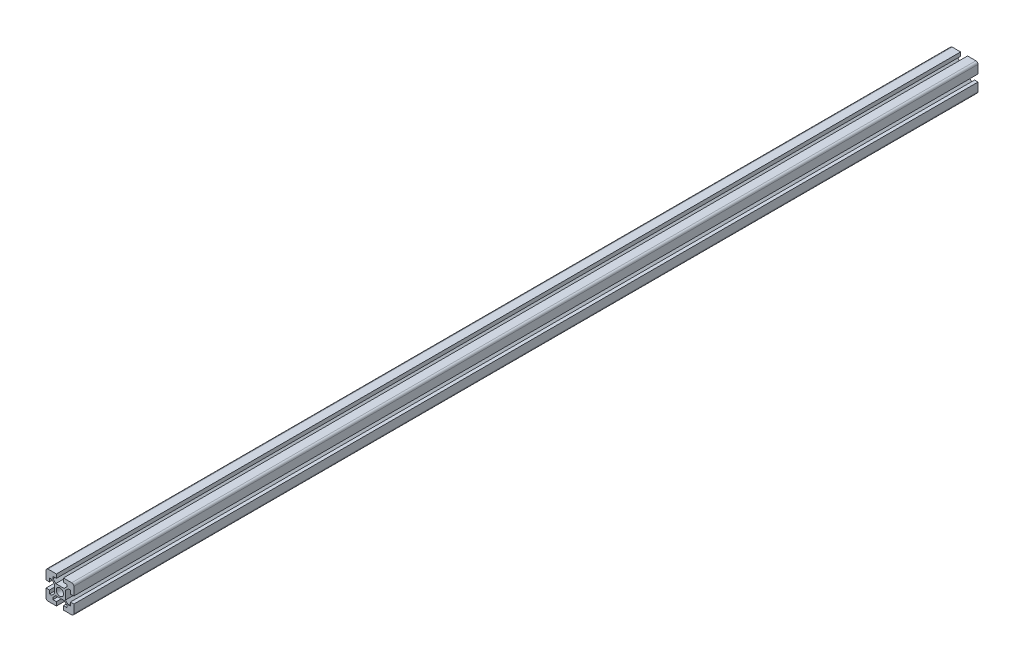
SolidWorks part; units mm, degrees
ref_plane "前基準面" through (0, 0, 0) normal (0, 0, 1) x (1, 0, 0)
ref_plane "上基準面" through (0, 0, 0) normal (0, 1, 0) x (1, 0, 0)
ref_plane "右基準面" through (0, 0, 0) normal (1, 0, 0) x (0, 0, -1)
sketch "草圖1" plane through (0, 0, 0) normal (0, 0, 1) x (1, 0, 0)
  line L0 (15, -5.5) -> (10, -5.5)
  line L1 (3, 0) -> (15, 0)
  line L2 (0, -3) -> (0, -15)
  line L3 (3, -40) -> (15, -40)
  line L4 (40, -3) -> (40, -15)
  line L5 (24.67, -40) -> (37, -40)
  line L6 (15, 0) -> (15, -5.5)
  line L7 (25, 0) -> (37, 0)
  line L8 (25, 0) -> (25, -5.5)
  line L9 (10, -5.5) -> (10, -8.5)
  line L10 (10, -8.5) -> (14, -12.5)
  line L11 (14, -12.5) -> (26, -12.5)
  line L12 (26, -12.5) -> (30, -8.5)
  line L13 (30, -8.5) -> (30, -5.5)
  line L14 (30, -5.5) -> (25, -5.5)
  line L17 (0, -25) -> (0, -37)
  line L18 (30, -34.5) -> (25, -34.5)
  line L19 (30, -31.5) -> (30, -34.5)
  line L20 (26, -27.5) -> (30, -31.5)
  line L21 (14, -27.5) -> (26, -27.5)
  line L22 (10, -31.5) -> (14, -27.5)
  line L23 (10, -34.5) -> (10, -31.5)
  line L24 (25, -40) -> (25, -34.5)
  line L25 (5, -15) -> (5, -10)
  line L26 (0, -15) -> (5, -15)
  line L27 (15, -40) -> (15, -34.5)
  line L28 (0, -25) -> (5, -25)
  line L29 (15, -34.5) -> (10, -34.5)
  line L30 (5, -10) -> (8, -10)
  line L31 (8, -10) -> (12, -14)
  line L32 (12, -14) -> (12, -26)
  line L33 (12, -26) -> (8, -30)
  line L34 (8, -30) -> (5, -30)
  line L35 (5, -30) -> (5, -25)
  line L36 (35, -30) -> (35, -25)
  line L37 (32, -30) -> (35, -30)
  line L38 (28, -26) -> (32, -30)
  line L39 (28, -14) -> (28, -26)
  line L40 (32, -10) -> (28, -14)
  line L41 (35, -10) -> (32, -10)
  line L42 (40, -25) -> (35, -25)
  line L43 (40, -15) -> (35, -15)
  line L44 (35, -15) -> (35, -10)
  line L45 (40, -25) -> (40, -37)
  circle A0 centre (20, -20) radius 5.25
  arc A1 (37, -40) -> (40, -37) centre (37, -37) ccw
  arc A2 (0, -37) -> (3, -40) centre (3, -37) ccw
  arc A3 (37, 0) -> (40, -3) centre (37, -3) cw
  arc A4 (3, 0) -> (0, -3) centre (3, -3) ccw
  point P52 (0, -40)
  point P55 (40, 0)
  point P58 (0, 0)
  dimension "D23" = 10.5
  dimension "D26" = 3
  dimension "D1" = 40
  dimension "D2" = 40
  dimension "D3" = 10
  dimension "D4" = 20
  dimension "D5" = 5
  dimension "D6" = 7
  dimension "D7" = 7
  dimension "D8" = 5.5
  dimension "D9" = 12
  dimension "D10" = 4
  dimension "D11" = 4
  dimension "D12" = 20
  dimension "D13" = 10
  dimension "D14" = 5
  dimension "D15" = 5
  dimension "D16" = 7
  dimension "D17" = 12
  dimension "D18" = 4
  dimension "D19" = 3
  dimension "D20" = 3
  dimension "D21" = 15
  dimension "D22" = 15
  dimension "D24" = 20
  dimension "D25" = 20
extrude "填料-伸長1" add sketch "草圖1" along normal blind 1300 contours L1 A4 L2 L26 L25 L30 L31 L32 L33 L34 L35 L28 L17 A2 L3 L27 L29 L23 L22 L21 L20 L19 L18 L24 L5 A1 L45 L42 L36 L37 L38 L39 L40 L41 L44 L43 L4 A3 L7 L8 L14 L13 L12 L11 L10 L9 L0 L6 A0
